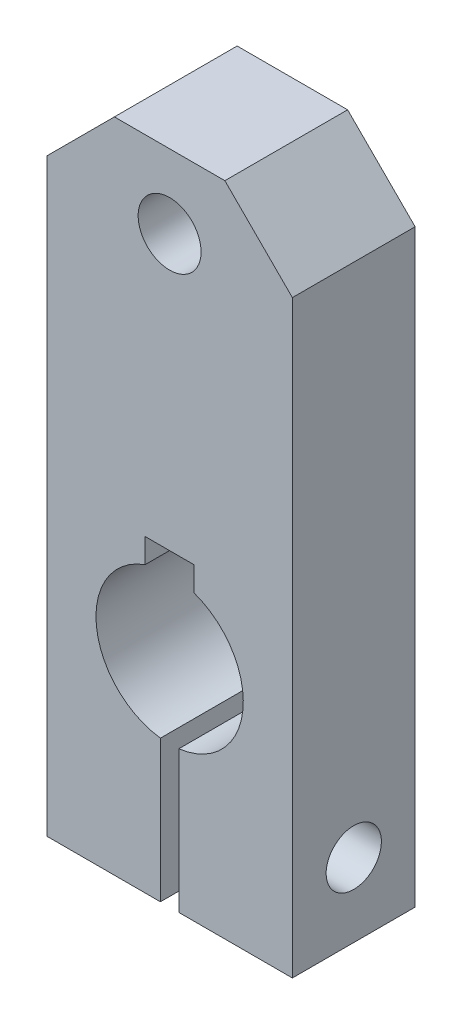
SolidWorks part; units mm, degrees
ref_plane "Face" through (0, 0, 0) normal (0, 0, 1) x (1, 0, 0)
ref_plane "Dessus" through (0, 0, 0) normal (0, 1, 0) x (1, 0, 0)
ref_plane "Droite" through (0, 0, 0) normal (1, 0, 0) x (0, 0, -1)
sketch "Esquisse1" plane through (0, 0, 0) normal (0, 0, 1) x (1, 0, 0)
  line L0 (9, 107) -> (20, 96)
  line L1 (-9, 107) -> (9, 107)
  line L2 (-20, 96) -> (-20, 0)
  line L3 (-20, 0) -> (-1.5, 0)
  line L4 (20, 96) -> (20, 0)
  line L5 (-20, 96) -> (-9, 107)
  line L6 (1.5, 23.0941) -> (1.5, 0)
  line L7 (-1.5, 23.0941) -> (-1.5, 0)
  line L8 (1.5, 0) -> (20, 0)
  line L10 (-4, 50.3) -> (4, 50.3)
  line L11 (-4, 50.3) -> (-4, 46.3137)
  line L13 (4, 50.3) -> (4, 46.3137)
  arc A0 (1.5, 23.0941) -> (4, 46.3137) centre (0, 35) ccw
  circle A1 centre (0, 95) radius 5.125
  arc A2 (-4, 46.3137) -> (-1.5, 23.0941) centre (0, 35) ccw
  point P0 (-20, 107)
  point P3 (20, 107)
  point P18 (0, 50.3)
  dimension "D5" = 24
  dimension "D7" = 10.25
  dimension "D3" = 11
  dimension "D4" = 11
  dimension "D1" = 107
  dimension "D2" = 40
  dimension "D6" = 35
  dimension "D8" = 20
  dimension "D9" = 1.5
  dimension "D10" = 3
  dimension "D11" = 12
  dimension "D12" = 8
  dimension "D13" = 15.3
extrude "Base-Extrusion" add sketch "Esquisse1" along normal mid plane 20
sketch "Esquisse2" plane through (20, 0, 0) normal (1, 0, 0) x (0, 0, -1)
  circle A0 centre (0, 12) radius 4.5
  dimension "D1" = 9
  dimension "D2" = 12
extrude "Enlèv. mat.-Extru.1" cut sketch "Esquisse2" against normal up to next
sketch "Esquisse3" plane through (-1.5, 0, 0) normal (1, 0, 0) x (0, 0, -1)
  circle A0 centre (0, 12) radius 3.375
  circle A1 centre (0, 12) radius 4.5 construction
  dimension "D1" = 6.75
extrude "Trou taraudé" cut sketch "Esquisse3" against normal through all
